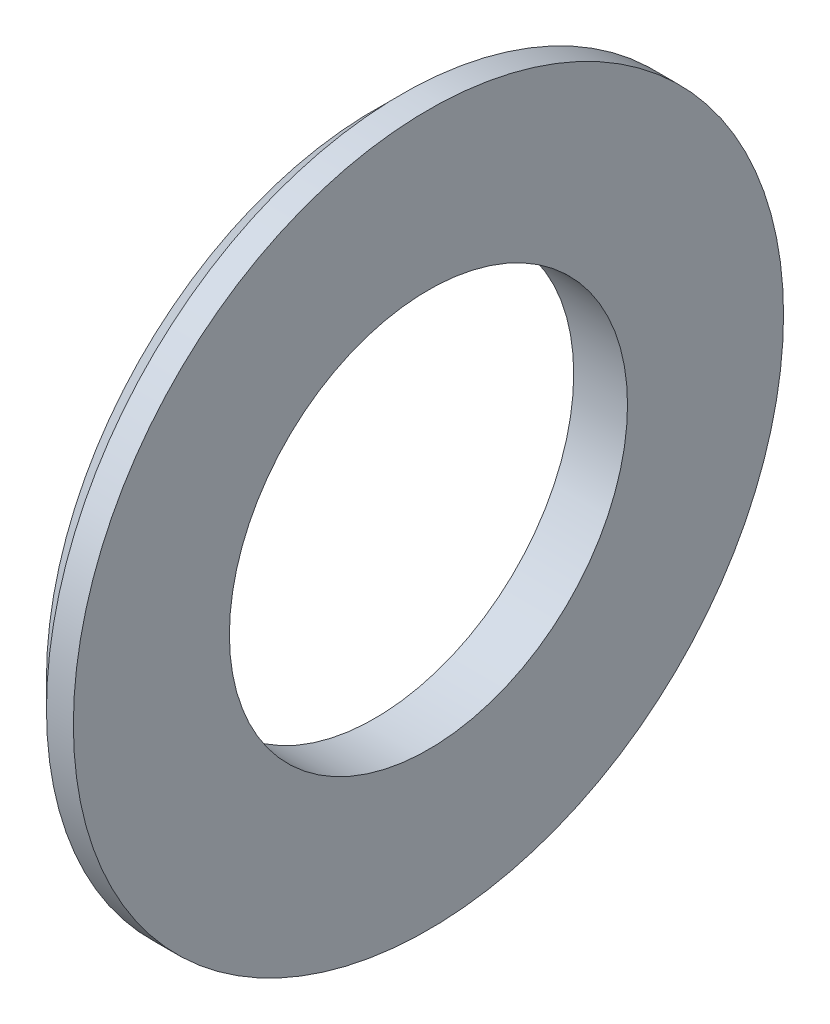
SolidWorks part; units mm, degrees
ref_plane "Plane1" through (0, 0, 0) normal (0, 0, 1) x (1, 0, 0)
ref_plane "Plane2" through (0, 0, 0) normal (0, 1, 0) x (1, 0, 0)
ref_plane "Plane3" through (0, 0, 0) normal (1, 0, 0) x (0, 0, -1)
sketch "Sketch1" plane through (0, 0, 0) normal (0, 0, 1) x (1, 0, 0)
  line L0 (-34.925, 0) -> (9.525, 0) construction
  line L1 (0, 18.5) -> (0, 33)
  line L2 (0, 33) -> (-2.5, 33)
  line L3 (-5, 30.5) -> (-5, 18.5)
  line L4 (-5, 18.5) -> (0, 18.5)
  line L5 (-5, 30.5) -> (-2.5, 33)
  dimension "D2" = 45
  dimension "D3" = 2.5
  dimension "Thickness" = 5
  dimension "Inside_dia" = 37
  dimension "Outside_dia" = 66
revolve "Base-Revolve" add sketch "Sketch1" angle 360 about L0
equation "\"D3@Sketch1\" = \"Thickness@Sketch1\" * .5"
